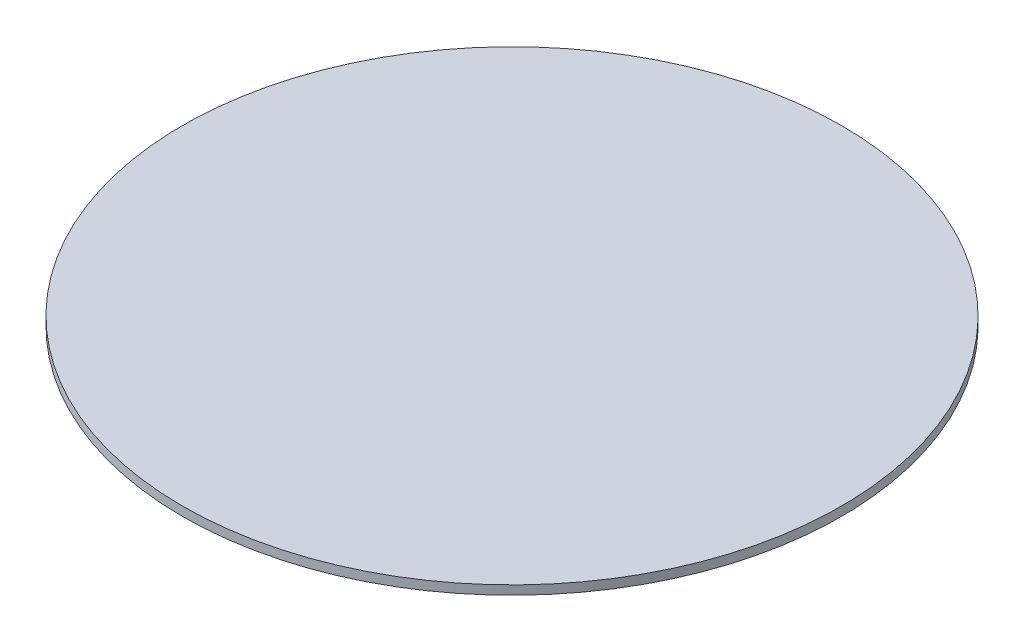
SolidWorks part; units mm, degrees
ref_plane "Alzado" through (0, 0, 0) normal (0, 0, 1) x (1, 0, 0)
ref_plane "Planta" through (0, 0, 0) normal (0, 1, 0) x (1, 0, 0)
ref_plane "Vista lateral" through (0, 0, 0) normal (1, 0, 0) x (0, 0, -1)
sketch "Croquis1" plane through (0, 0, 0) normal (0, 1, 0) x (1, 0, 0)
  circle A0 centre (0, 0) radius 110
  dimension "D1" = 220
extrude "Saliente-Extruir1" add sketch "Croquis1" along normal blind 3
sketch "Croquis2" plane through (0, 0, 0) normal (0, -1, 0) x (1, 0, 0)
  circle A0 centre (80, 0) radius 11
  dimension "D1" = 22
  dimension "D2" = 80
extrude "Saliente-Extruir2" add sketch "Croquis2" along normal blind 15 draft 5 separate body
fillet "Redondeo1" radius 1 1 edges at (80, -15, -9.6877)
pattern_circular "MatrizC1" count 4 over 360 about axis through (0, 0, 0) along (0, 1, 0)
